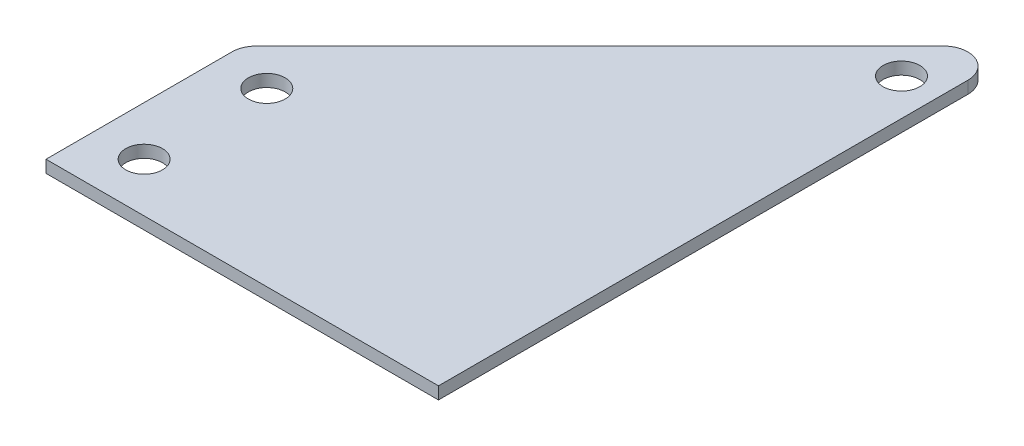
SolidWorks part; units mm, degrees
ref_plane "Front Plane" through (0, 0, 0) normal (0, 0, 1) x (1, 0, 0)
ref_plane "Top Plane" through (0, 0, 0) normal (0, 1, 0) x (1, 0, 0)
ref_plane "Right Plane" through (0, 0, 0) normal (1, 0, 0) x (0, 0, -1)
sketch "Sketch1" plane through (0, 0, 0) normal (0, 1, 0) x (1, 0, 0)
  line L0 (0, 0) -> (0, 274.066)
  line L1 (-21.6803, 283.0463) -> (-199.4803, 105.2463)
  line L2 (-203.2, 96.266) -> (-203.2, 0)
  line L3 (-203.2, 0) -> (0, 0)
  arc A0 (-199.4803, 105.2463) -> (-203.2, 96.266) centre (-190.5, 96.266) ccw
  arc A1 (0, 274.066) -> (-21.6803, 283.0463) centre (-12.7, 274.066) ccw
  circle A3 centre (-177.8, 25.4) radius 9.525
  circle A4 centre (-177.8, 88.9) radius 9.525
  circle A6 centre (-19.05, 258.7357) radius 9.525
  point P11 (0, 0)
  dimension "D1" = 12.7
  dimension "D7" = 25.4
  dimension "D8" = 19.05
  dimension "D9" = 19.05
  dimension "D10" = 19.05
  dimension "D12" = 19.05
  dimension "D2" = 203.2
  dimension "D3" = 274.066
  dimension "D4" = 96.266
  dimension "D5" = 25.4
  dimension "D6" = 25.4
  dimension "D11" = 63.5
  dimension "D13" = 19.05
extrude "Boss-Extrude1" add sketch "Sketch1" along normal blind 6.35
